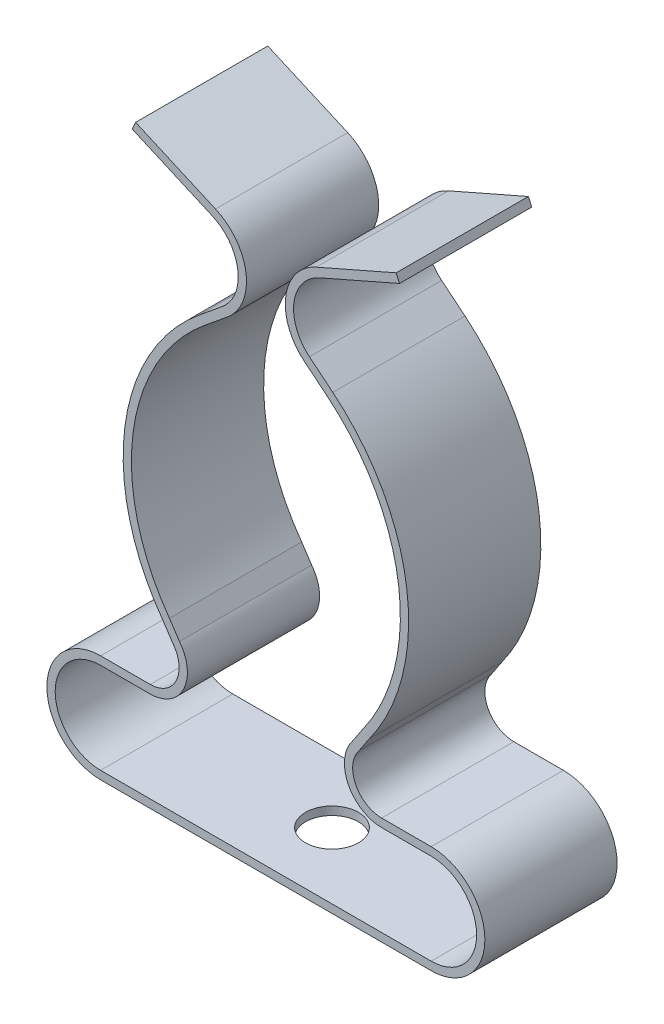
SolidWorks part; units mm, degrees
ref_plane "Plan de face" through (0, 0, 0) normal (0, 0, 1) x (1, 0, 0)
ref_plane "Plan de dessus" through (0, 0, 0) normal (0, 1, 0) x (1, 0, 0)
ref_plane "Plan de droite" through (0, 0, 0) normal (1, 0, 0) x (0, 0, -1)
sketch "Esquisse1" plane through (0, 0, 0) normal (0, 0, 1) x (1, 0, 0)
  line L0 (-7.3629, 0) -> (35.8646, 0) construction
  line L1 (0, -11.0444) -> (0, 50.7092) construction
  line L2 (-7.3629, 35) -> (35.8646, 35) construction
  line L3 (13, -11.0444) -> (13, 46.9505) construction
  line L4 (5, -4.3191) -> (5, 10.9808) construction
  line L5 (1.5, 28.0445) -> (1.5, 40.9628) construction
  line L6 (18.3012, 3) -> (9.1926, 3) construction
  line L7 (10, 6.2117) -> (10, -0.6704) construction
  line L8 (8, 44.1437) -> (8, 13.7375) construction
  line L9 (0, 0) -> (10, 0)
  line L10 (-3.999, 17) -> (24.6296, 17) construction
  line L11 (20.9352, 6) -> (-0.7267, 6) construction
  line L12 (7, 9.1544) -> (7, 4.8198) construction
  line L13 (4.3236, 8) -> (16.334, 8) construction
  line L14 (7, 6) -> (10, 6)
  line L15 (5.4301, 9.2392) -> (6.0409, 10.1574)
  line L16 (3.8899, 26.885) -> (2.4769, 28.0445)
  line L17 (7.9854, 35.0332) -> (3.147, 32.9105)
  arc A0 (10, 0) -> (10, 6) centre (10, 3) ccw
  arc A1 (6.0409, 10.1574) -> (3.8899, 26.885) centre (-3.9092, 17.38) ccw
  arc A2 (5.4301, 9.2392) -> (7, 6) centre (7, 8) ccw
  arc A3 (3.147, 32.9105) -> (2.4769, 28.0445) centre (4.3046, 30.2719) ccw
  dimension "D9" = 6
  dimension "D1" = 35
  dimension "D2" = 3
  dimension "D3" = 13
  dimension "D4" = 5
  dimension "D5" = 1.5
  dimension "D6" = 8
  dimension "D7" = 3
  dimension "D8" = 17
  dimension "D10" = 2
  dimension "D11" = 2
sketch "Esquisse2" plane through (0, 0, 0) normal (1, 0, 0) x (0, 0, -1)
  line L0 (5.3483, 0) -> (-5.7875, 0) construction
  line L1 (5.3483, 0) -> (2.4921, 0) construction
  line L2 (-4.4548, -0.25) -> (8.2191, -0.25) construction
  line L3 (-4.4548, 0.25) -> (8.2191, 0.25) construction
  line L4 (4, 0.7506) -> (4, -4.5062) construction
  line L5 (-4, 0.7506) -> (-4, -4.5062) construction
  line L6 (0, -1.2189) -> (0, 0.7837) construction
  line L8 (-4, 0.25) -> (4, 0.25)
  line L9 (-4, 0.25) -> (-4, -0.25)
  line L10 (-4, -0.25) -> (4, -0.25)
  line L11 (4, 0.25) -> (4, -0.25)
  dimension "D1" = 4
  dimension "D2" = 0.25
  dimension "D3" = 8
  dimension "D4" = 0.5
sweep "Balayage1" add profiles "Esquisse2" path "Esquisse1"
mirror "Symétrie1" about plane through (0, -0.25, 4) normal (1, 0, 0) of "Balayage1"
sketch "Esquisse3" plane through (0, 0.25, 0) normal (0, 1, 0) x (-1, 0, 0)
  circle A0 centre (0, 0) radius 1.6
extrude "Enlèv. mat.-Extru.1" cut sketch "Esquisse3" against normal blind 2
